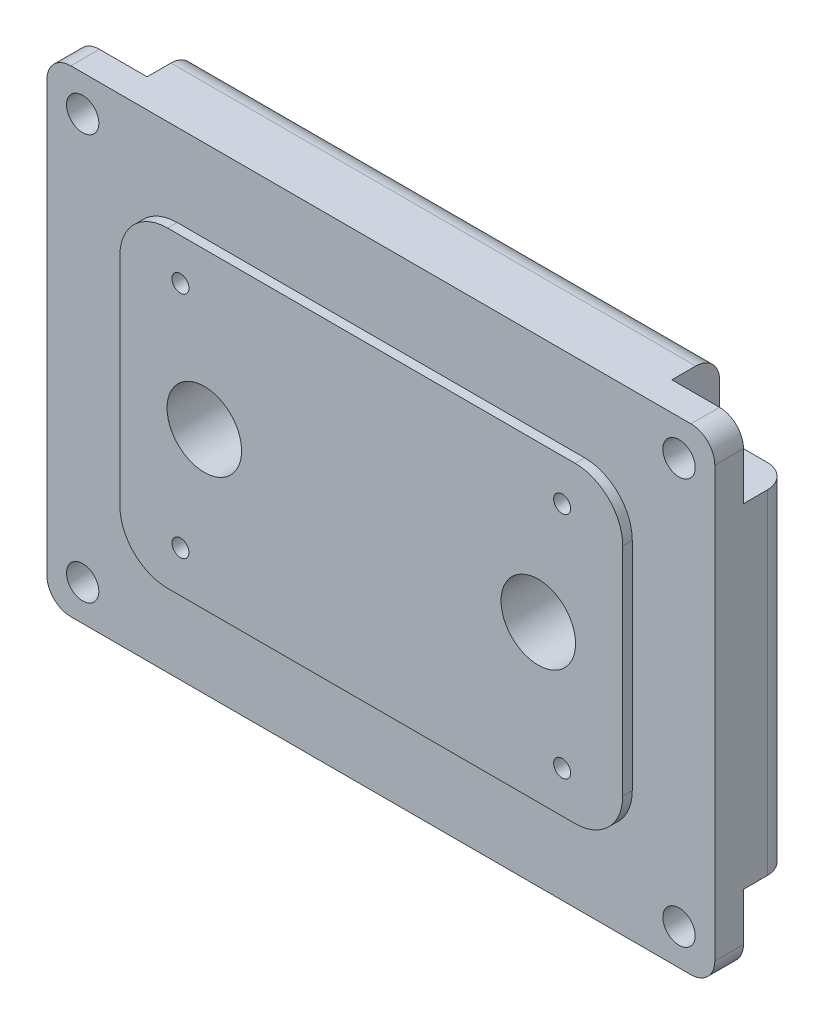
SolidWorks part; units mm, degrees
ref_plane "Front" through (0, 0, 0) normal (0, 0, 1) x (1, 0, 0)
ref_plane "Top" through (0, 0, 0) normal (0, 1, 0) x (1, 0, 0)
ref_plane "Right" through (0, 0, 0) normal (1, 0, 0) x (0, 0, -1)
sketch "Sketch1" plane through (0, 0, 0) normal (0, 0, 1) x (1, 0, 0)
  line L0 (0, 0) -> (0, -31.75) construction
  line L1 (-44.45, -31.75) -> (44.45, -31.75)
  line L2 (-44.45, -31.75) -> (-44.45, 31.75)
  line L3 (-44.45, 31.75) -> (44.45, 31.75)
  line L4 (44.45, -31.75) -> (44.45, 31.75)
  line L5 (0, 0) -> (-44.45, 0) construction
  dimension "D1" = 88.9
  dimension "D2" = 63.5
extrude "Boss-Extrude1" add sketch "Sketch1" along normal blind 10.16
sketch "Sketch2" plane through (0, 0, 10.16) normal (0, 0, 1) x (1, 0, 0)
  line L0 (0, 0) -> (-33.4645, 0) construction
  line L1 (-33.4645, -20.7645) -> (33.4645, -20.7645)
  line L2 (-33.4645, -20.7645) -> (-33.4645, 20.7645)
  line L3 (-33.4645, 20.7645) -> (33.4645, 20.7645)
  line L4 (33.4645, -20.7645) -> (33.4645, 20.7645)
  line L6 (0, 0) -> (0, -20.7645) construction
  dimension "D1" = 66.929
  dimension "D2" = 41.529
extrude "Boss-Extrude2" add sketch "Sketch2" along normal blind 1.27
hole_wizard "7/16-20 Tapped Hole1" positions "Sketch4" profile "Sketch3" tap size "7/16-20" standard "ANSI Inch"
sketch "Sketch4" plane through (0, 0, 0) normal (0, 0, -1) x (-1, 0, 0)
  line L0 (-22.225, 0) -> (22.225, 0) construction
  point P0 (-22.225, 0)
  point P2 (22.225, 0)
  dimension "D1" = 44.45
sketch "Sketch3" plane through (22.225, 0, 0) normal (1, 0, 0) x (0, 1, 0)
  line L0 (0, 0) -> (0, 11.43)
  line L1 (0, 11.43) -> (4.9606, 11.43)
  line L2 (4.9606, 11.43) -> (4.9606, 0)
  line L5 (4.9606, 0) -> (0, 0)
  line L11 (0, -6.35) -> (0, 107.95) construction
  dimension "Thread Major Dia." = 9.9212
  dimension "Thru Tap Drill Depth" = 11.43
fillet "Fillet1" radius 6.35 4 edges at (-33.4645, -20.7645, 10.795) (33.4645, -20.7645, 10.795) (33.4645, 20.7645, 10.795) (-33.4645, 20.7645, 10.795)
fillet "Fillet2" radius 3.175 8 edges at (-44.45, -31.75, 5.08) (-44.45, 31.75, 5.08) (-44.45, 0, 0) (0, -31.75, 0) (44.45, -31.75, 5.08) (44.45, 0, 0) (44.45, 31.75, 5.08) (0, 31.75, 0)
hole_wizard "#4-40 Tapped Hole2" positions "Sketch6" profile "Sketch5" tap size "#4-40" standard "ANSI Inch"
sketch "Sketch6" plane through (0, 0, 11.43) normal (0, 0, 1) x (1, 0, 0)
  line L1 (-25.4, 15.24) -> (25.4, 15.24) construction
  line L2 (-25.4, 15.24) -> (-25.4, -15.24) construction
  line L3 (-25.4, -15.24) -> (25.4, -15.24) construction
  line L4 (25.4, 15.24) -> (25.4, -15.24) construction
  line L5 (0, 0) -> (0, 15.24) construction
  line L8 (0, 0) -> (-25.4, 0) construction
  point P1 (-25.4, 15.24)
  point P2 (25.4, -15.24)
  point P207 (-25.4, -15.24)
  point P208 (25.4, 15.24)
  dimension "D1" = 50.8
  dimension "D2" = 30.48
sketch "Sketch5" plane through (-25.4, 15.24, 11.43) normal (1, 0, 0) x (0, -1, 0)
  line L0 (0, 0) -> (0, 10.2042)
  line L1 (0, 10.2042) -> (1.1303, 9.525)
  line L2 (1.1303, 9.525) -> (1.1303, 0)
  line L5 (1.1303, 0) -> (0, 0)
  line L10 (0, 10.2042) -> (-1.1303, 9.525) construction
  line L11 (0, -6.35) -> (0, 107.95) construction
  dimension "Tap Drill Dia." = 2.2606
  dimension "Tap Drill Depth" = 9.525
  dimension "Drill Angle" = 118
sketch "Sketch7" plane through (0, 0, 0) normal (0, 0, -1) x (-1, 0, 0)
  line L0 (-44.45, -28.575) -> (-44.45, 28.575) construction
  line L1 (-44.45, 22.225) -> (-38.1, 22.225)
  line L2 (-44.45, 22.225) -> (-44.45, 31.75)
  line L3 (-44.45, 31.75) -> (-34.925, 31.75)
  line L4 (-34.925, 25.4) -> (-34.925, 31.75)
  line L5 (-41.275, 31.75) -> (41.275, 31.75) construction
  arc A0 (-34.925, 25.4) -> (-38.1, 22.225) centre (-38.1, 25.4) cw
  point P10 (-34.925, 22.225)
  dimension "D3" = 3.175
  dimension "D1" = 9.525
  dimension "D2" = 9.525
extrude "Cut-Extrude1" cut sketch "Sketch7" against normal blind 6.35
hole_wizard "#8 Clearance Hole1" positions "Sketch9" profile "Sketch8" hole size "#8" standard "ANSI Inch"
sketch "Sketch9" plane through (0, 0, 6.35) normal (0, 0, -1) x (-1, 0, 0)
  line L0 (-34.925, 31.75) -> (-41.275, 31.75) construction
  line L1 (-44.45, 28.575) -> (-44.45, 22.225) construction
  point P0 (-39.6875, 26.9875)
  point P3 (-38.1, 31.75)
  dimension "D1" = 4.7625
  dimension "D2" = 4.7625
sketch "Sketch8" plane through (39.6875, 26.9875, 6.35) normal (1, 0, 0) x (0, 1, 0)
  line L0 (0, 0) -> (0, 3.811)
  line L1 (0, 3.811) -> (2.1526, 3.811)
  line L2 (2.1526, 3.811) -> (2.1526, 0)
  line L5 (2.1526, 0) -> (0, 0)
  line L11 (0, -6.35) -> (0, 107.95) construction
  dimension "Thru Hole Dia." = 4.3053
  dimension "Thru Hole Depth" = 3.811
mirror "Mirror1" about plane through (0, 0, 0) normal (0, 1, 0) of "#8 Clearance Hole1", "Cut-Extrude1"
mirror "Mirror2" about plane through (0, 0, 0) normal (1, 0, 0) of "#8 Clearance Hole1", "Cut-Extrude1", "Mirror1"
hole_wizard "#8-32 Tapped Hole1" positions "Sketch13" profile "Sketch12" tap size "#8-32" standard "ANSI Inch"
sketch "Sketch13" plane through (0, 0, 0) normal (0, 0, -1) x (-1, 0, 0)
  line L1 (-8.128, 24.765) -> (8.128, 24.765)
  line L2 (-8.128, 24.765) -> (-8.128, 15.875)
  line L3 (-8.128, 15.875) -> (8.128, 15.875)
  line L4 (8.128, 24.765) -> (8.128, 15.875)
  line L6 (0, 15.875) -> (0, 0) construction
  point P1 (-8.128, 24.765)
  point P2 (8.128, 15.875)
  point P105 (-8.128, 15.875)
  point P106 (8.128, 24.765)
  dimension "D1" = 8.89
  dimension "D2" = 16.256
  dimension "D3" = 15.875
sketch "Sketch12" plane through (8.128, 24.765, 0) normal (1, 0, 0) x (0, 1, 0)
  line L0 (0, 0) -> (0, 7.3878)
  line L1 (0, 7.3878) -> (1.7272, 6.35)
  line L2 (1.7272, 6.35) -> (1.7272, 0)
  line L5 (1.7272, 0) -> (0, 0)
  line L10 (0, 7.3878) -> (-1.7272, 6.35) construction
  line L11 (0, -6.35) -> (0, 107.95) construction
  dimension "Tap Drill Dia." = 3.4544
  dimension "Tap Drill Depth" = 6.35
  dimension "Drill Angle" = 118
